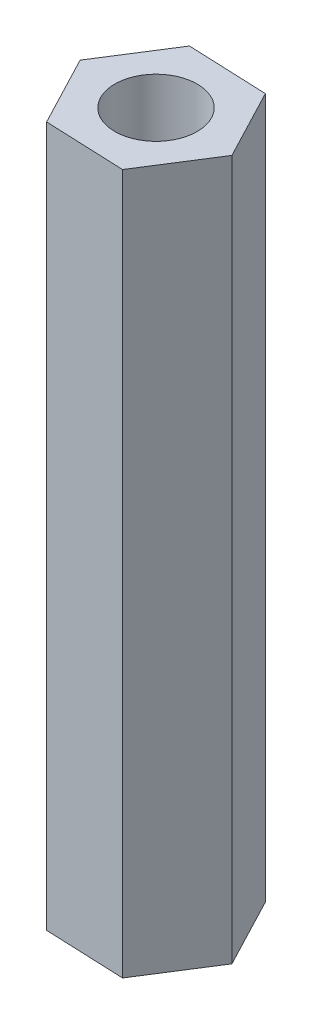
SolidWorks part; units mm, degrees
ref_plane "Ebene vorne" through (0, 0, 0) normal (0, 0, 1) x (1, 0, 0)
ref_plane "Ebene oben" through (0, 0, 0) normal (0, 1, 0) x (1, 0, 0)
ref_plane "Ebene rechts" through (0, 0, 0) normal (1, 0, 0) x (0, 0, -1)
sketch "Skizze1" plane through (0, 0, 0) normal (0, 1, 0) x (1, 0, 0)
  line L1 (1.3385, -2.5577) -> (2.8843, -0.1196)
  line L2 (2.8843, -0.1196) -> (1.5457, 2.438)
  line L3 (1.5457, 2.438) -> (-1.3385, 2.5577)
  line L4 (-1.3385, 2.5577) -> (-2.8843, 0.1196)
  line L5 (-2.8843, 0.1196) -> (-1.5457, -2.438)
  line L6 (-1.5457, -2.438) -> (1.3385, -2.5577)
  circle A0 centre (0, 0) radius 2.5 construction
  circle A1 centre (0, 0) radius 1.5
  dimension "D1" = 5
  dimension "D2" = 3
extrude "Aufsatz-Linear austragen1" add sketch "Skizze1" along normal blind 25.5
